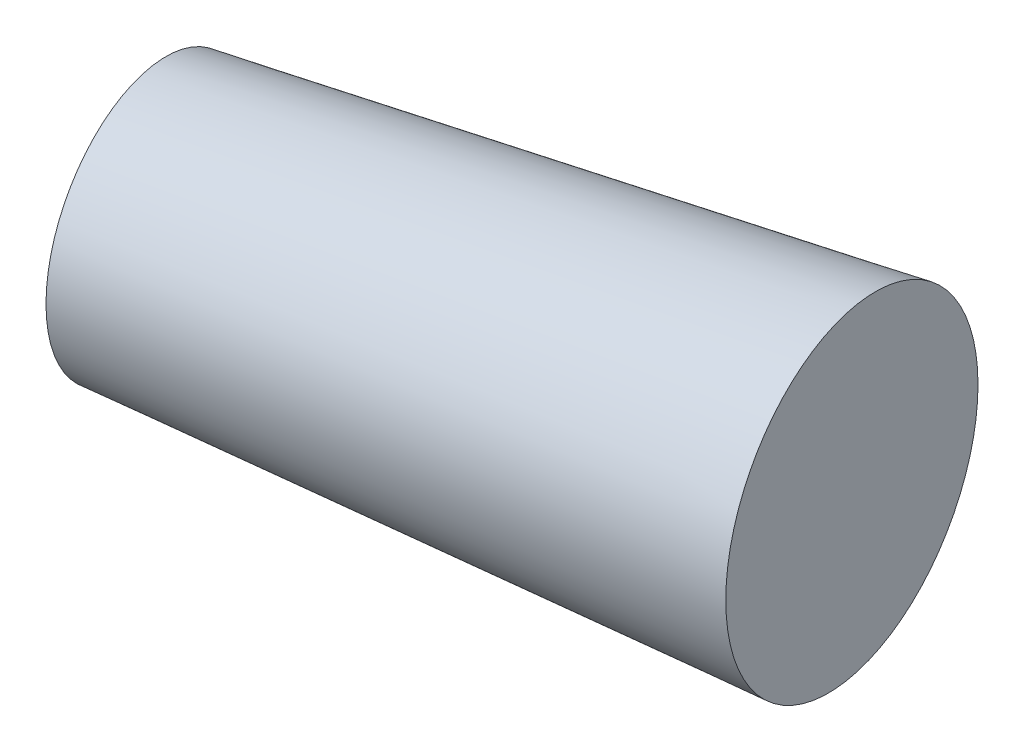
SolidWorks part; units mm, degrees
ref_plane "Plan1" through (0, 0, 0) normal (0, 0, 1) x (1, 0, 0)
ref_plane "Plan2" through (0, 0, 0) normal (0, 1, 0) x (1, 0, 0)
ref_plane "Plan3" through (0, 0, 0) normal (1, 0, 0) x (0, 0, -1)
sketch "Esquisse1" plane through (0, 0, 0) normal (0, 1, 0) x (1, 0, 0)
  line L1 (0, 0) -> (7.5, 1.4516) construction
  line L2 (0, 0) -> (7.5, 1.4516) construction
  line L4 (-5.7985, -3.369) -> (-6.6368, 0.9622) construction
  line L5 (-6.6368, 0.9622) -> (3.4549, 3.4697) construction
  line L6 (4.5, -1.9301) -> (3.4549, 3.4697) construction
  line L7 (-6.2177, -1.2034) -> (3.9774, 0.7698)
  line L8 (-6.2177, -1.2034) -> (-6.6368, 0.9622)
  line L9 (-6.6368, 0.9622) -> (3.4549, 3.4697)
  line L10 (3.9774, 0.7698) -> (3.4549, 3.4697)
revolve "Base-Révolution" add sketch "Esquisse1" angle 360 about L2
